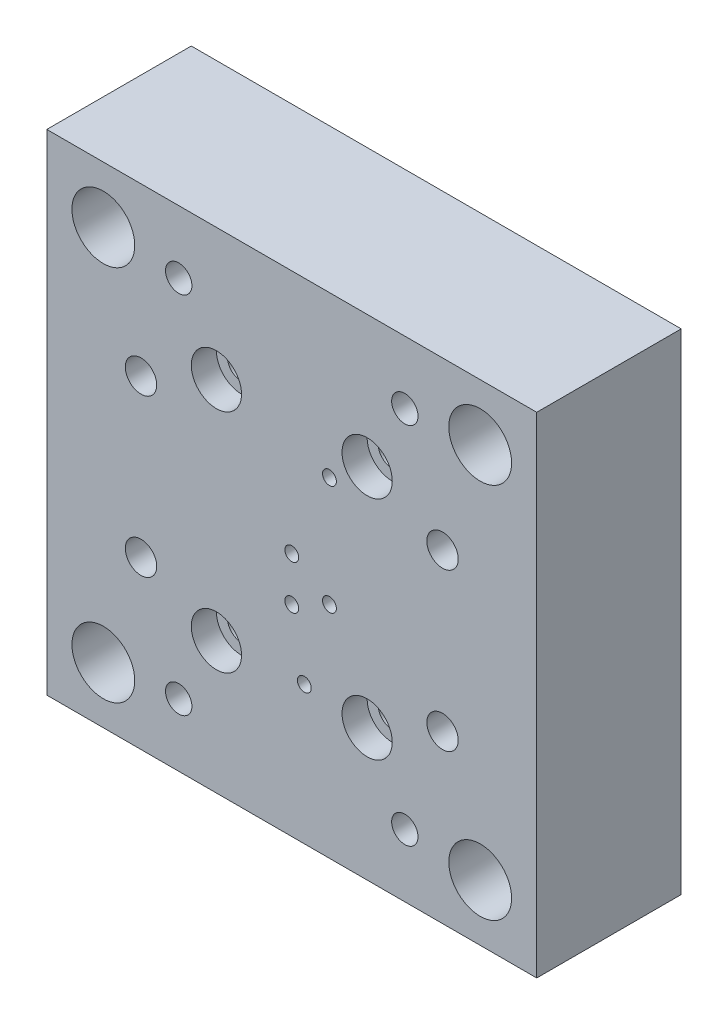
SolidWorks part; units mm, degrees
ref_plane "Face" through (0, 0, 0) normal (0, 0, 1) x (1, 0, 0)
ref_plane "Dessus" through (0, 0, 0) normal (0, 1, 0) x (1, 0, 0)
ref_plane "Droite" through (0, 0, 0) normal (1, 0, 0) x (0, 0, -1)
sketch "Esquisse1" plane through (0, 0, 0) normal (0, 0, 1) x (1, 0, 0)
  line L0 (0, 24.2535) -> (0, -21.149) construction
  line L1 (-39, 39) -> (39, 39)
  line L2 (-39, 39) -> (-39, -39)
  line L3 (-39, -39) -> (39, -39)
  line L4 (39, 39) -> (39, -39)
  line L5 (-22.1192, 0) -> (25.9997, 0) construction
  dimension "D1" = 78
  dimension "D2" = 78
extrude "Extrusion1" add sketch "Esquisse1" along normal blind 23
sketch "Esquisse2" plane through (0, 0, 23) normal (0, 0, 1) x (1, 0, 0)
  line L0 (-14.0196, 0) -> (16.0447, 0) construction
  line L1 (0, 12.5398) -> (0, -13.7859) construction
  circle A0 centre (-30, 30) radius 5
  circle A1 centre (30, 30) radius 5
  circle A2 centre (30, -30) radius 5
  circle A3 centre (-30, -30) radius 5
  dimension "D1" = 10
  dimension "D2" = 60
  dimension "D3" = 60
extrude "Enlèv. mat.-Extru.1" cut sketch "Esquisse2" against normal through all
hole_wizard "Trou taraudé M5x0.81" positions "Esquisse4" profile "Esquisse3" tap size "M5x0.8" standard "ISO"
sketch "Esquisse4" plane through (0, 0, 23) normal (0, 0, 1) x (1, 0, 0)
  line L0 (0, -5.9963) -> (0, 8.9955) construction
  line L1 (-8.571, 0) -> (17.0976, 0) construction
  point P0 (18, 29)
  point P1 (-18, 29)
  point P2 (-18, -29)
  point P3 (18, -29)
  dimension "D1" = 58
  dimension "D2" = 36
sketch "Esquisse3" plane through (18, 29, 23) normal (1, 0, 0) x (0, -1, 0)
  line L0 (0, 0) -> (0, 15.2618)
  line L1 (0, 15.2618) -> (2.1, 14)
  line L2 (2.1, 14) -> (2.1, 0)
  line L5 (2.1, 0) -> (0, 0)
  line L10 (0, 15.2618) -> (-2.1, 14) construction
  line L11 (0, -6.35) -> (0, 107.95) construction
  dimension "Diamètre du trou pour taraudage" = 4.2
  dimension "Profondeur du trou pour taraudage" = 14
  dimension "Angle de pointe" = 118
sketch "Esquisse5" plane through (0, 0, 23) normal (0, 0, 1) x (1, 0, 0)
  line L0 (-8.8069, 0) -> (6.8498, 0) construction
  line L1 (0, 7.6779) -> (0, -5.4197) construction
  circle A0 centre (24, 12.5) radius 2.5
  circle A1 centre (24, -12.5) radius 2.5
  circle A2 centre (-24, -12.5) radius 2.5
  circle A3 centre (-24, 12.5) radius 2.5
  dimension "D1" = 5
  dimension "D2" = 48
  dimension "D3" = 25
extrude "Enlèv. mat.-Extru.2" cut sketch "Esquisse5" against normal through all
sketch "Esquisse6" plane through (0, 0, 0) normal (0, 0, 1) x (1, 0, 0)
  line L0 (0, 9.0827) -> (0, -10.2038) construction
  line L1 (-12, 24) -> (12, 24)
  line L2 (-18, 18) -> (-18, -18)
  line L3 (-12, -24) -> (12, -24)
  line L4 (18, 18) -> (18, -18)
  line L5 (-7.4995, 0) -> (9.9417, 0) construction
  arc A0 (12, 24) -> (18, 18) centre (12, 18) cw
  arc A1 (-12, 24) -> (-18, 18) centre (-12, 18) ccw
  arc A2 (-18, -18) -> (-12, -24) centre (-12, -18) ccw
  arc A3 (12, -24) -> (18, -18) centre (12, -18) ccw
  dimension "D3" = 6
  dimension "D1" = 48
  dimension "D2" = 36
extrude "Enlèv. mat.-Extru.3" cut sketch "Esquisse6" along normal blind 12
hole_wizard "Chambrage pour vis à tête hexagonale M41" positions "Esquisse8" profile "Esquisse7" counterbore size "M4" standard "ISO"
sketch "Esquisse8" plane through (0, 0, 23) normal (0, 0, 1) x (1, 0, 0)
  line L0 (-12.749, 0) -> (11.8242, 0) construction
  line L2 (0, 7.002) -> (0, -9.3801) construction
  point P0 (12, 18)
  point P1 (-12, 18)
  point P3 (-12, -18)
  point P5 (12, -18)
  dimension "D1" = 18
  dimension "D2" = 12
sketch "Esquisse7" plane through (12, 18, 23) normal (1, 0, 0) x (0, -1, 0)
  line L0 (0, 0) -> (0, 23)
  line L1 (0, 23) -> (2.25, 23)
  line L3 (2.25, 23) -> (2.25, 4)
  line L4 (2.25, 4) -> (4, 4)
  line L5 (4, 4) -> (4, 0)
  line L7 (4, 0) -> (0, 0)
  line L11 (0, -6.35) -> (0, 107.95) construction
  dimension "Diamètre du perçage jusqu'au prochain" = 4.5
  dimension "Profondeur du perçage jusqu'au prochain" = 23
  dimension "Diamètre du chambrage" = 8
  dimension "Profondeur du chambrage" = 4
sketch "Esquisse9" plane through (0, 0, 12) normal (0, 0, -1) x (-1, 0, 0)
  line L0 (-10.6352, 0) -> (11.0315, 0) construction
  line L1 (0, 0.376) -> (0, -4.624) construction
  circle A0 centre (0, 0) radius 1.1
  circle A1 centre (0, -7) radius 1.1
  circle A2 centre (-2, -17) radius 1.1
  circle A3 centre (-6, -4) radius 1.1
  circle A4 centre (-6, 13.5) radius 1.1
  dimension "D1" = 2.2
  dimension "D2" = 7
  dimension "D3" = 17
  dimension "D4" = 4
  dimension "D5" = 13.5
  dimension "D7" = 2
  dimension "D8" = 6
extrude "Enlèv. mat.-Extru.4" cut sketch "Esquisse9" against normal through all
